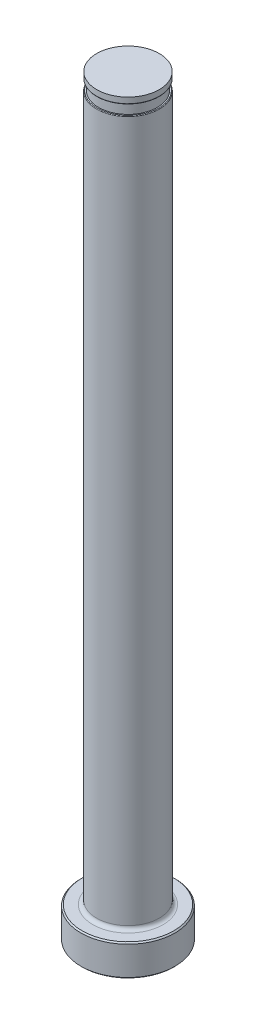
SolidWorks part; units mm, degrees
ref_plane "Front Plane" through (0, 0, 0) normal (0, 0, 1) x (1, 0, 0)
ref_plane "Top Plane" through (0, 0, 0) normal (0, 1, 0) x (1, 0, 0)
ref_plane "Right Plane" through (0, 0, 0) normal (1, 0, 0) x (0, 0, -1)
other "Configuration Table"
sketch "Sketch1" plane through (0, 0, 0) normal (0, 0, 1) x (1, 0, 0)
  line L0 (0, 259.9588) -> (0, -15.1925) construction
  line L1 (0, 0) -> (-9.525, 0)
  line L2 (-9.525, 0) -> (-9.525, 6.35)
  line L3 (-9.525, 6.35) -> (-6.35, 6.35)
  line L4 (-6.35, 6.35) -> (-6.35, 152.4)
  line L5 (-6.35, 152.4) -> (0, 152.4)
  line L6 (0, 152.4) -> (0, 0)
  dimension "L" = 152.4
  dimension "H" = 19.05
  dimension "T" = 6.35
  dimension "D" = 12.7
revolve "Revolve1" add sketch "Sketch1" angle 360 about L0
chamfer "Chamfer1" distance 0.254 angle 45 2 edges at (0, 6.35, 9.525) (0, 0, 9.525)
fillet "Fillet1" radius 0.762 1 edges at (0, 6.35, 6.35)
sketch "Sketch2" plane through (0, 0, 0) normal (0, 0, 1) x (1, 0, 0)
  line L0 (-6.35, 152.4) -> (-6.35, 7.112) construction
  line L1 (-6.35, 151.13) -> (-5.969, 151.13)
  line L2 (-6.35, 151.13) -> (-6.35, 149.098)
  line L3 (-6.35, 149.098) -> (-5.969, 149.098)
  line L4 (-5.969, 151.13) -> (-5.969, 149.098)
  line L5 (6.35, 152.4) -> (-6.35, 152.4) construction
  line L6 (0, 153.4483) -> (0, 147.3282) construction
  dimension "D1" = 2.032
  dimension "N" = 1.27
  dimension "FD" = 0.381
  dimension "D3" = 11.938
revolve "Vent Relief" cut sketch "Sketch2" angle 360 about L6
sketch "Sketch3" plane through (0, 0, 0) normal (0, 0, 1) x (1, 0, 0)
  line L0 (-5.969, 150.114) -> (-5.969, 86.614)
  line L1 (-5.969, 151.13) -> (-5.969, 149.098) construction
  line L2 (-6.35, 149.098) -> (-6.35, 7.112) construction
  line L3 (-6.35, 85.106) -> (-6.35, 150.114)
  line L4 (-6.35, 150.114) -> (-5.969, 150.114)
  arc A0 (-5.969, 86.614) -> (-6.35, 85.106) centre (-9.144, 86.614) cw
  dimension "D1" = 3.175
  dimension "D2" = 63.5
extrude "D-Slot" cut sketch "Sketch3" against normal through all both and the other way through all
sketch "Sketch5" plane through (0, 0, 0) normal (0, 0, 1) x (1, 0, 0)
  line L0 (-6.35, 151.13) -> (6.35, 151.13) construction
  line L1 (-6.35, 152.4) -> (-6.3373, 152.4)
  line L2 (-6.35, 152.4) -> (-6.35, 151.13)
  line L3 (-6.35, 151.13) -> (-6.3373, 151.13)
  line L4 (-6.3373, 152.4) -> (-6.3373, 151.13)
  line L5 (0, 152.6877) -> (0, 150.5771) construction
  dimension "VP" = 0.0127
revolve "Vent Diameter" cut sketch "Sketch5" angle 360 about L5
fillet "Fillet2" radius 0.127 2 edges at (6.35, 149.098, 0) (0, 151.13, 6.3373)
sketch "Pocket Sketch" plane through (0, 0, 0) normal (0, 0, 1) x (1, 0, 0)
  line L0 (-9.9219, 0) -> (-9.9219, 6.3754)
  line L1 (-9.9219, 6.3754) -> (-7.5089, 6.3754)
  line L2 (-6.7469, 7.1374) -> (-6.7469, 22.225)
  line L3 (-6.7469, 22.225) -> (0, 22.225)
  line L4 (0, 22.225) -> (0, 0)
  line L5 (0, 0) -> (-9.9219, 0)
  line L6 (0, 12.6104) -> (0, -2.4989) construction
  line L7 (-9.525, 6.096) -> (-9.525, 0.254) construction
  line L8 (9.271, 6.35) -> (-9.271, 6.35) construction
  line L9 (-6.35, 85.106) -> (-6.35, 7.112) construction
  line L10 (-7.5089, 6.3754) -> (-6.7469, 7.1374)
  point P3 (-6.7469, 6.3754)
  dimension "D1" = 19.8437
  dimension "D2" = 0.3969
  dimension "D3" = 0.0254
  dimension "D4" = 0.3969
  dimension "D5" = 13.4937
  dimension "D6" = 22.225
